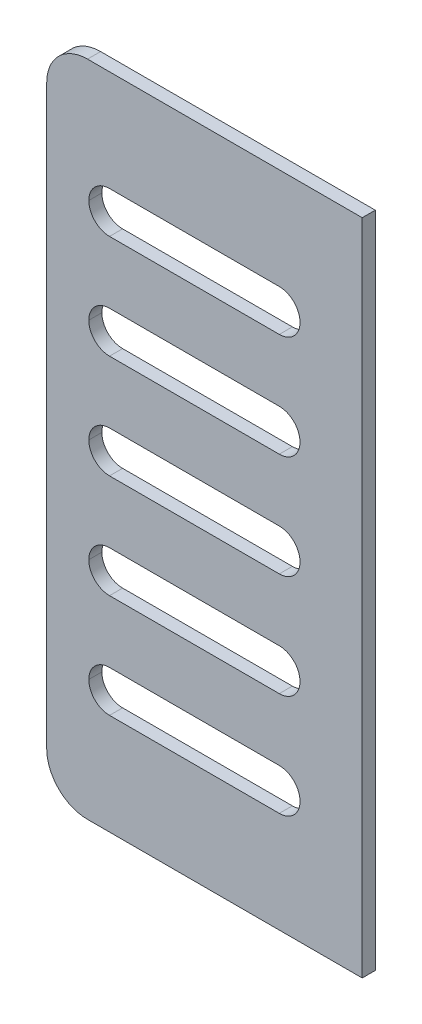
SolidWorks part; units mm, degrees
ref_plane "Front Plane" through (0, 0, 0) normal (0, 0, 1) x (1, 0, 0)
ref_plane "Top Plane" through (0, 0, 0) normal (0, 1, 0) x (1, 0, 0)
ref_plane "Right Plane" through (0, 0, 0) normal (1, 0, 0) x (0, 0, -1)
sketch "Sketch1" plane through (0, 0, 0) normal (0, 0, 1) x (1, 0, 0)
  line L0 (-514.9814, -391.9256) -> (-128.5414, -391.9256)
  line L1 (-514.9814, 414.4744) -> (-514.9814, -391.9256)
  line L2 (-128.5414, 414.4744) -> (-128.5414, -391.9256)
  line L4 (-514.9814, 414.4744) -> (-128.5414, 414.4744)
  line L40 (-204.7414, -217.3256) -> (-463.4414, -217.3256)
  line L45 (-204.7414, -217.3256) -> (-204.7414, -268.1256)
  line L46 (-204.7414, -268.1256) -> (-463.4414, -268.1256)
  line L47 (-463.4414, -217.3256) -> (-463.4414, -268.1256)
  line L48 (-204.7414, -90.3256) -> (-463.4414, -90.3256)
  line L49 (-204.7414, -90.3256) -> (-204.7414, -141.1256)
  line L50 (-204.7414, -141.1256) -> (-463.4414, -141.1256)
  line L51 (-463.4414, -90.3256) -> (-463.4414, -141.1256)
  line L52 (-204.7414, 36.6744) -> (-463.4414, 36.6744)
  line L53 (-204.7414, 36.6744) -> (-204.7414, -14.1256)
  line L54 (-204.7414, -14.1256) -> (-463.4414, -14.1256)
  line L55 (-463.4414, 36.6744) -> (-463.4414, -14.1256)
  line L56 (-204.7414, 163.6744) -> (-463.4414, 163.6744)
  line L57 (-204.7414, 163.6744) -> (-204.7414, 112.8744)
  line L58 (-204.7414, 112.8744) -> (-463.4414, 112.8744)
  line L59 (-463.4414, 163.6744) -> (-463.4414, 112.8744)
  line L60 (-204.7414, 290.6744) -> (-463.4414, 290.6744)
  line L61 (-204.7414, 290.6744) -> (-204.7414, 239.8744)
  line L62 (-204.7414, 239.8744) -> (-463.4414, 239.8744)
  line L63 (-463.4414, 290.6744) -> (-463.4414, 239.8744)
  point P0 (0, 0)
  dimension "D2" = 123.8
  dimension "D3" = 806.4
  dimension "D4" = 76.2
  dimension "D5" = 76.2
  dimension "D6" = 76.2
  dimension "D7" = 558.8
  dimension "D8" = 50.8
  dimension "D9" = 50.8
  dimension "D10" = 50.8
  dimension "D11" = 50.8
  dimension "D12" = 50.8
  dimension "D13" = 123.8
  dimension "D14" = 50.8
  dimension "D15" = 50.8
  dimension "D16" = 50.8
  dimension "D17" = 50.8
  dimension "D18" = 50.8
  dimension "D19" = 76.2
  dimension "D20" = 76.2
  dimension "D21" = 76.2
  dimension "D22" = 76.2
  dimension "D23" = 76.2
  dimension "D24" = 558.8
extrude "Boss-Extrude1" add sketch "Sketch1" along normal blind 16
fillet "Fillet1" radius 25.4 20 edges at (-463.4414, -217.3256, 8) (-463.4414, -90.3256, 8) (-463.4414, 36.6744, 8) (-463.4414, 163.6744, 8) (-463.4414, 290.6744, 8) (-463.4414, 239.8744, 8) (-463.4414, 112.8744, 8) (-463.4414, -14.1256, 8) (-463.4414, -141.1256, 8) (-463.4414, -268.1256, 8) (-204.7414, 290.6744, 8) (-204.7414, 163.6744, 8) (-204.7414, 36.6744, 8) (-204.7414, -90.3256, 8) (-204.7414, -217.3256, 8) (-204.7414, 239.8744, 8) (-204.7414, 112.8744, 8) (-204.7414, -14.1256, 8) (-204.7414, -141.1256, 8) (-204.7414, -268.1256, 8)
fillet "Fillet8" radius 50 2 edges at (-514.9814, 414.4744, 8) (-514.9814, -391.9256, 8)
equation "\"length\"= 36in"
equation "\"height\"= 18in"
equation "\"material thickness\"= 16mm"
equation "\"D1@Boss-Extrude1\"=\"material thickness\""
